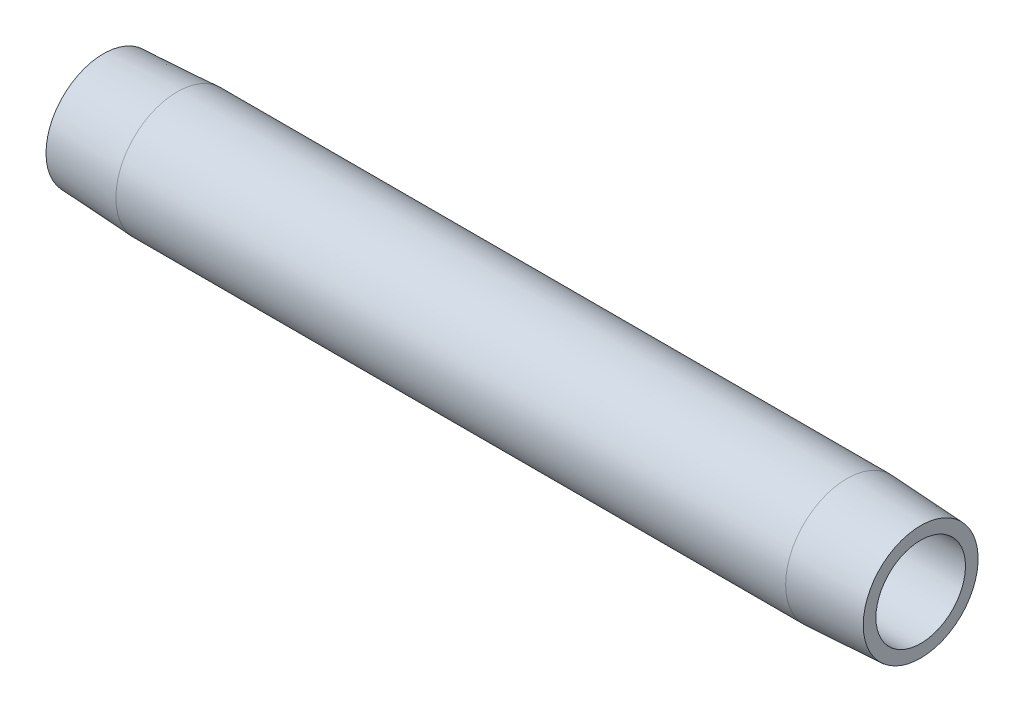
SolidWorks part; units mm, degrees
ref_plane "Front Plane" through (0, 0, 0) normal (0, 0, 1) x (1, 0, 0)
ref_plane "Top Plane" through (0, 0, 0) normal (0, 1, 0) x (1, 0, 0)
ref_plane "Right Plane" through (0, 0, 0) normal (1, 0, 0) x (0, 0, -1)
sketch "Sketch1" plane through (0, 0, 0) normal (0, 0, 1) x (1, 0, 0)
  line L5 (114.3, 6.2611) -> (0, 6.2611)
  line L6 (103.9876, 8.5725) -> (10.3124, 8.5725)
  line L7 (10.3124, 8.5725) -> (0, 8.0321)
  line L8 (114.3, 8.0321) -> (103.9876, 8.5725)
  line L9 (114.3, 6.2611) -> (114.3, 8.0321)
  line L10 (0, 6.2611) -> (0, 8.0321)
  line L11 (0, 0) -> (50000, 0) construction
  line L12 (0, -55) -> (0, 55) construction
  dimension "D1" = 12.5222
  dimension "D2" = 17.145
  dimension "D3" = 3
  dimension "D4" = 3
  dimension "D5" = 114.3
  dimension "D6" = 10.3124
  dimension "D7" = 10.3124
revolve "Revolve1" add sketch "Sketch1" angle 360 about L11
